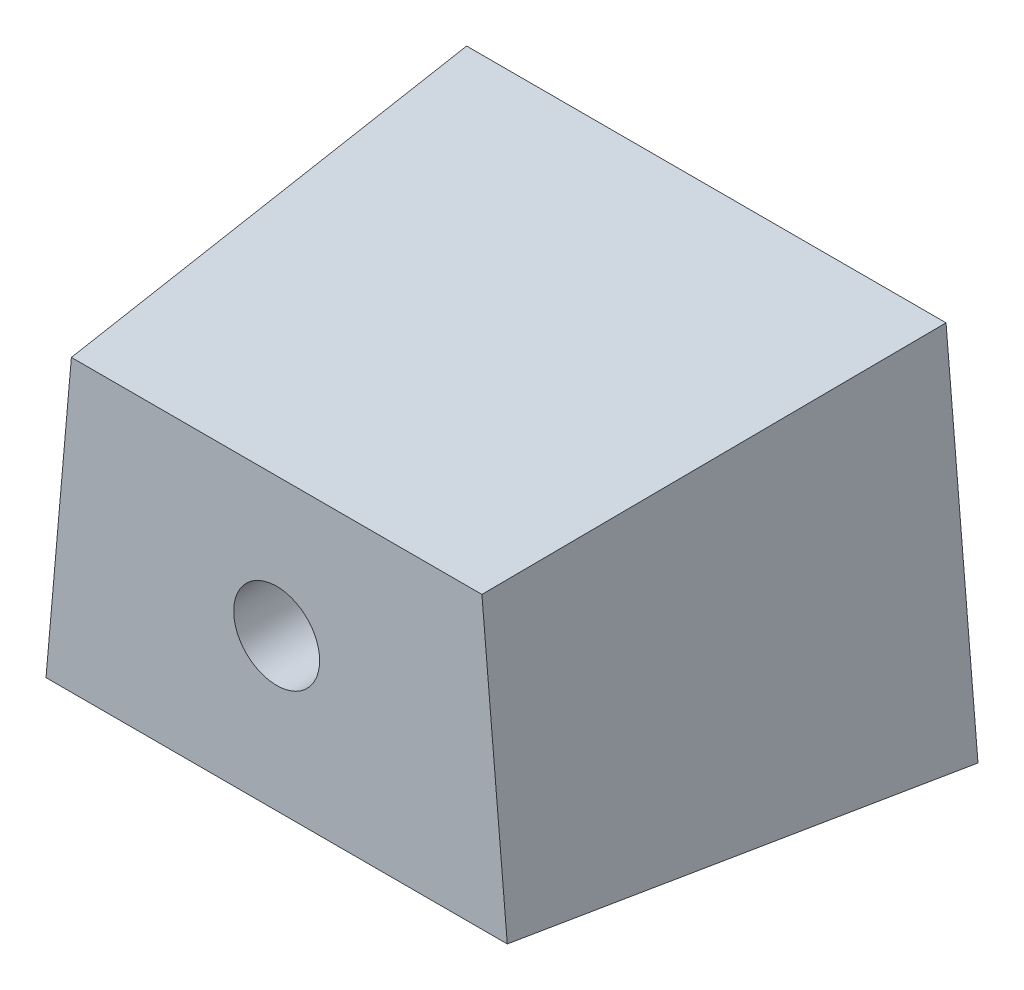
SolidWorks part; units mm, degrees
ref_plane "Ön Düzlem" through (0, 0, 0) normal (0, 0, 1) x (1, 0, 0)
ref_plane "Üst Düzlem" through (0, 0, 0) normal (0, 1, 0) x (1, 0, 0)
ref_plane "Sağ Düzlem" through (0, 0, 0) normal (1, 0, 0) x (0, 0, -1)
sketch "Çizim1" plane through (0, 0, 0) normal (0, 0, 1) x (1, 0, 0)
  line L0 (-22, 20) -> (22, 20)
  line L5 (22, 20) -> (25.5, -20.0052)
  line L6 (25.5, -20.0052) -> (-25.5, -20.0052)
  line L7 (-25.5, -20.0052) -> (-22, 20)
  dimension "D1" = 44
  dimension "D2" = 51
  dimension "D3" = 95
  dimension "D4" = 95
  dimension "D5" = 40.0052
  dimension "D6" = 85
  dimension "D7" = 85
  dimension "D8" = 22
  dimension "D9" = 20
  dimension "D10" = 40.158
  dimension "D11" = 40.158
extrude "Yükseklik-Ekstrüzyon1" add sketch "Çizim1" along normal blind 40 draft 5
sketch "Çizim2" plane through (0, 0, 40) normal (0, 0, 1) x (1, 0, 0)
  circle A0 centre (0, 0) radius 4
  dimension "D1" = 8
extrude "Kes-Ekstrüzyon1" cut sketch "Çizim2" against normal blind 8
sketch "Çizim3" plane through (0, 0, 0) normal (0, 0, -1) x (-1, 0, 0)
  line L0 (22.3155, 16.3935) -> (-22.3155, 16.3935)
  line L1 (22, 20) -> (25.5, -20.0052) construction
  line L2 (-25.5, -20.0052) -> (-22, 20) construction
  line L3 (25.2901, -17.6065) -> (-25.2901, -17.6065)
  line L4 (-25.0779, 19.3935) -> (24.9221, 19.3935) construction
  line L7 (22.3155, 16.3935) -> (22, 20)
  line L8 (22, 20) -> (-22, 20)
  line L9 (-22, 20) -> (-22.3155, 16.3935)
  line L10 (25.2901, -17.6065) -> (25.5, -20.0052)
  line L11 (25.5, -20.0052) -> (-25.5, -20.0052)
  line L12 (-25.5, -20.0052) -> (-25.2901, -17.6065)
  dimension "D1" = 3
  dimension "D2" = 34
extrude "Kes-Ekstrüzyon2" cut sketch "Çizim3" against normal blind 50 draft 5
sketch "Çizim4" plane through (0, 0, 0) normal (0, 0, -1) x (-1, 0, 0)
  circle A0 centre (0, 0) radius 4
  dimension "D1" = 8
extrude "Kes-Ekstrüzyon3" cut sketch "Çizim4" against normal blind 5
